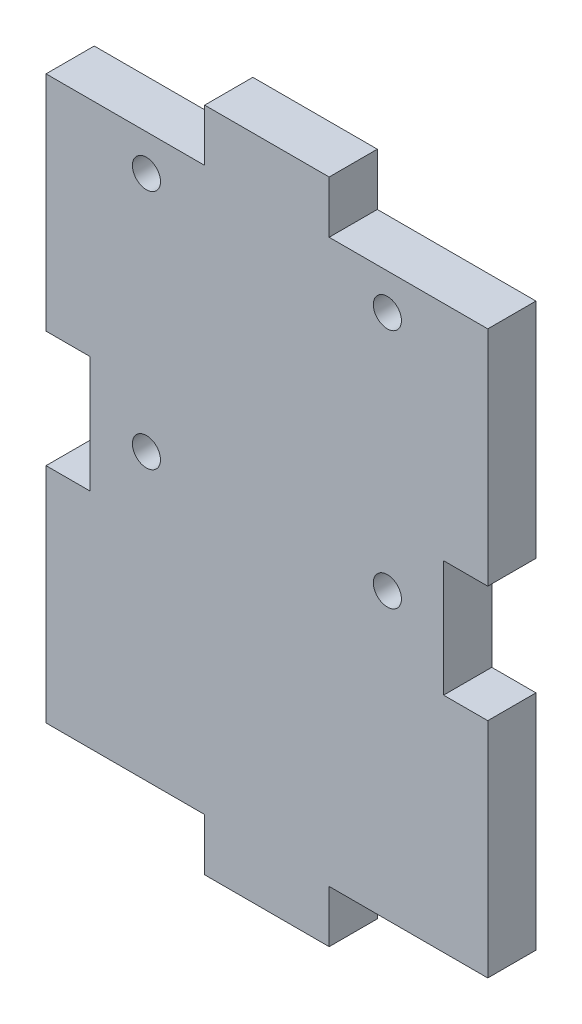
SolidWorks part; units mm, degrees
ref_plane "Front Plane" through (0, 0, 0) normal (0, 0, 1) x (1, 0, 0)
ref_plane "Top Plane" through (0, 0, 0) normal (0, 1, 0) x (1, 0, 0)
ref_plane "Right Plane" through (0, 0, 0) normal (1, 0, 0) x (0, 0, -1)
sketch "Sketch1" plane through (0, 0, 0) normal (0, 0, 1) x (1, 0, 0)
  line L0 (0, 0) -> (0, 60341.1464) construction
  line L1 (0, 0) -> (-50000, 0) construction
  line L2 (-27.5, -35) -> (-7.75, -35)
  line L3 (-27.5, -35) -> (-27.5, -7.25)
  line L4 (-27.5, 35) -> (-7.75, 35)
  line L5 (27.5, -35) -> (27.5, -7.25)
  line L6 (-27.5, -35) -> (27.5, 35) construction
  line L7 (-27.5, 35) -> (27.5, -35) construction
  line L9 (-7.75, 35) -> (-7.75, 41.5)
  line L10 (-7.75, 41.5) -> (7.75, 41.5)
  line L11 (7.75, 35) -> (7.75, 41.5)
  line L12 (7.75, -35) -> (27.5, -35)
  line L18 (27.5, -7.25) -> (22, -7.25)
  line L19 (-27.5, -7.25) -> (-22, -7.25)
  line L21 (-27.5, 7.25) -> (-22, 7.25)
  line L22 (-22, -7.25) -> (-22, 7.25)
  line L23 (27.5, 7.25) -> (27.5, 35)
  line L24 (7.75, 35) -> (27.5, 35)
  line L26 (22, -7.25) -> (22, 7.25)
  line L28 (27.5, 7.25) -> (22, 7.25)
  line L30 (-7.75, -41.5) -> (7.75, -41.5)
  line L31 (-7.75, -35) -> (-7.75, -41.5)
  line L32 (7.75, -35) -> (7.75, -41.5)
  line L36 (-27.5, 7.25) -> (-27.5, 35)
  point P3 (0, 0)
  point P8 (0, 35)
  point P12 (0, 41.5)
  point P13 (0, -35)
  point P16 (-27.5, 0)
  point P19 (-22, 0)
  point P27 (0, -41.5)
  point P28 (-7.75, -41.5)
  point P33 (0, -35)
  point P34 (0, 0)
  dimension "D1" = 55
  dimension "D2" = 70
  dimension "D3" = 6.5
  dimension "D4" = 15.5
  dimension "D5" = 5.5
  dimension "D6" = 14.5
  dimension "D7" = 5.5
  dimension "D8" = 6.5
extrude "Boss-Extrude1" add sketch "Sketch1" along normal blind 6
sketch "Sketch2" plane through (0, 0, 6) normal (0, 0, 1) x (1, 0, 0)
  line L0 (0, 0) -> (0, 50000) construction
  line L1 (0, 15.5) -> (50000, 15.5) construction
  line L2 (7.75, 41.5) -> (-7.75, 41.5) construction
  circle A0 centre (-15, 30.5) radius 1.75
  circle A1 centre (15, 30.5) radius 1.75
  circle A2 centre (15, 0.5) radius 1.75
  circle A3 centre (-15, 0.5) radius 1.75
  dimension "D1" = 3.5
  dimension "D2" = 30
  dimension "D3" = 30
  dimension "D4" = 26
extrude "Cut-Extrude1" cut sketch "Sketch2" against normal through all both and the other way through all
